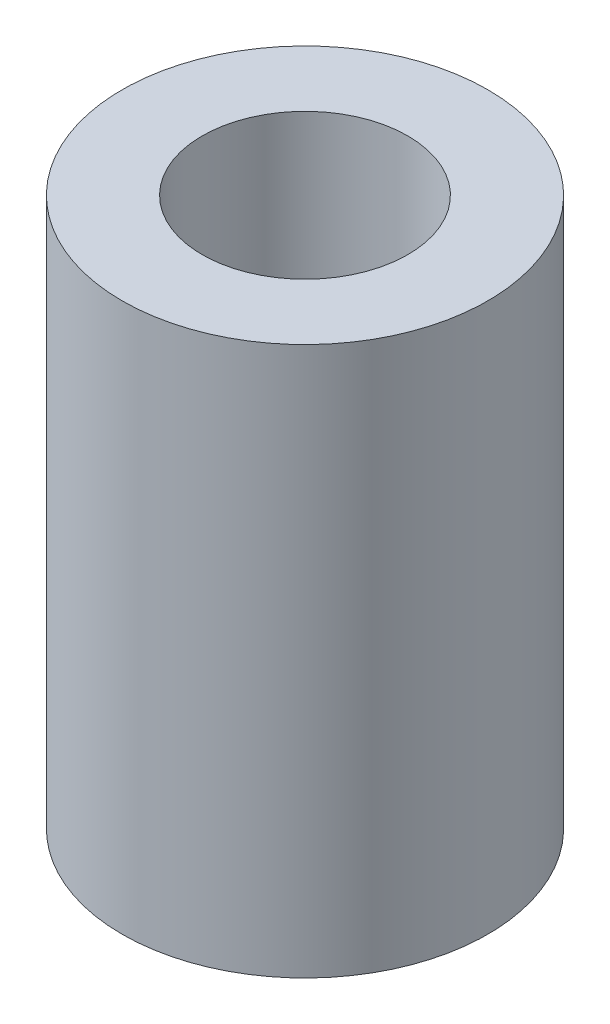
SolidWorks part; units mm, degrees
ref_plane "Front Plane" through (0, 0, 0) normal (0, 0, 1) x (1, 0, 0)
ref_plane "Top Plane" through (0, 0, 0) normal (0, 1, 0) x (1, 0, 0)
ref_plane "Right Plane" through (0, 0, 0) normal (1, 0, 0) x (0, 0, -1)
sketch "Sketch1" plane through (0, 0, 0) normal (0, 1, 0) x (1, 0, 0)
  circle A0 centre (0, 0) radius 6.35
  circle A1 centre (0, 0) radius 3.5719
  dimension "D1" = 7.1437
  dimension "D2" = 12.7
extrude "Boss-Extrude1" add sketch "Sketch1" along normal blind 19.05
